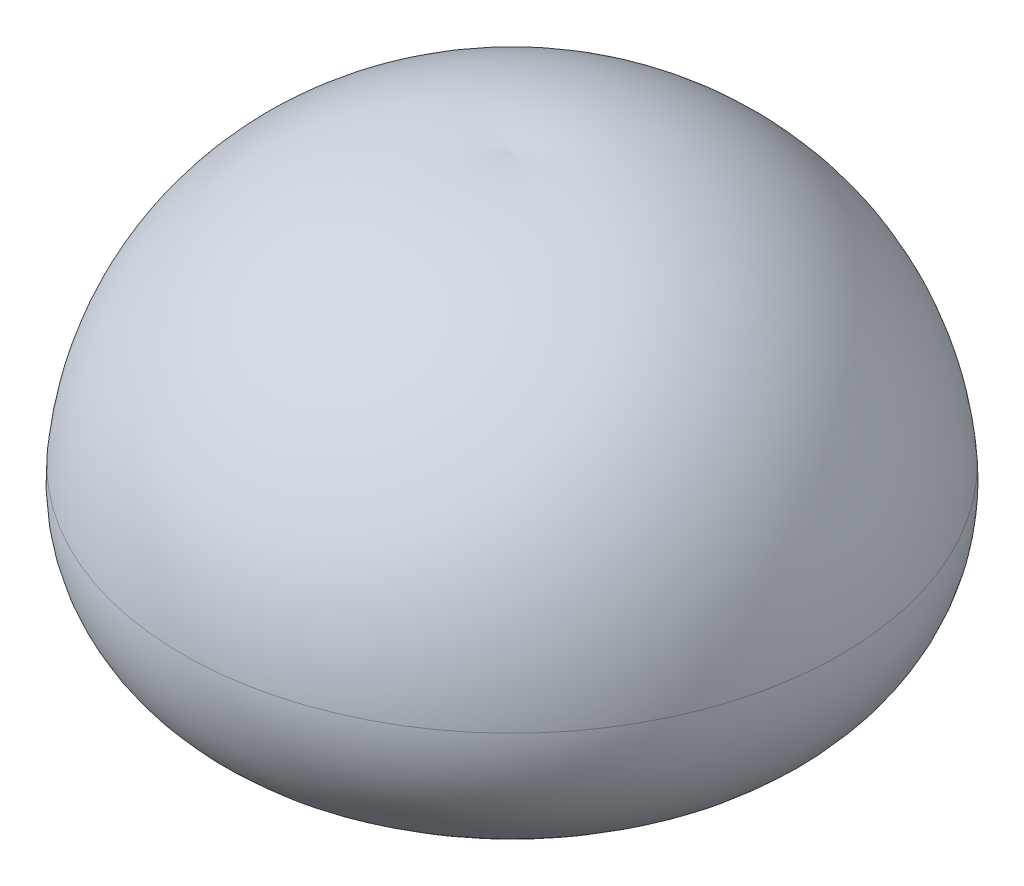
SolidWorks part; units mm, degrees
ref_plane "前视基准面" through (0, 0, 0) normal (0, 0, 1) x (1, 0, 0)
ref_plane "上视基准面" through (0, 0, 0) normal (0, 1, 0) x (1, 0, 0)
ref_plane "右视基准面" through (0, 0, 0) normal (1, 0, 0) x (0, 0, -1)
sketch "草图1" plane through (0, 0, 0) normal (0, 0, 1) x (1, 0, 0)
  line L0 (0, 860.3204) -> (0, -27.1227) construction
  line L1 (-196.265, 0) -> (315.568, 0) construction
  line L2 (300, 645) -> (-899.4452, 1337.5) construction
  line L3 (300, 645) -> (1679.7297, 765.7107) construction
  line L4 (300, 1071.2586) -> (300, 538.1611) construction
  line L5 (1679.7297, 765.7107) -> (1690.452, 965.4231) construction
  line L6 (1690.452, 965.4231) -> (3098.4242, 889.8304) construction
  line L7 (-899.4452, 1337.5) -> (-1022.7787, 1180.0553) construction
  line L8 (-1022.7787, 1180.0553) -> (-2132.7639, 2049.5569) construction
  line L9 (1679.7297, 765.7107) -> (1731.4935, 572.5255) construction
  line L10 (1731.4935, 572.5255) -> (369.5381, 207.5907) construction
  line L11 (1319.5558, 926.8817) -> (1319.5558, 45.241) construction
  line L12 (1319.5558, 45.241) -> (1296.2796, -86.7648) construction
  line L13 (1319.5558, 45.241) -> (1343.4101, -90.0433) construction
  line L14 (1319.5558, 190.9816) -> (1243.487, 234.8999) construction
  line L15 (1319.5558, 190.9816) -> (1430.874, 200.7207) construction
  line L16 (1319.5558, 372.2851) -> (1233.3752, 340.918) construction
  line L17 (1319.5558, 372.2851) -> (1338.973, 262.165) construction
  line L18 (1319.5558, 631.6387) -> (1370.1273, 492.6947) construction
  line L19 (1319.5558, 631.6387) -> (1271.182, 498.7326) construction
  line L20 (1319.5558, 817.0834) -> (1182.6552, 680.1828) construction
  line L21 (1319.5558, 817.0834) -> (1471.4957, 665.1436) construction
  line L22 (-899.4452, 1337.5) -> (-702.4836, 1302.7704) construction
  line L23 (-702.4836, 1302.7704) -> (-947.3276, -85.8086) construction
  line L24 (-899.4452, 1337.5) -> (-831.0412, 1525.4385) construction
  line L25 (-831.0412, 1525.4385) -> (493.9254, 1043.1901) construction
  line L26 (1679.7297, 765.7107) -> (1498.4681, 681.1871) construction
  line L27 (1498.4681, 681.1871) -> (902.5764, 1959.081) construction
  line L28 (0, -27.1227) -> (0, 0)
  line L29 (0, 2059.1808) -> (0, 3438.0485)
  arc A0 (3098.4242, 889.8304) -> (369.5381, 207.5907) centre (1679.7297, 765.7107) cw
  arc A1 (3098.4242, 889.8304) -> (-2132.7639, 2049.5569) centre (300, 645) ccw
  arc A2 (-2132.7639, 2049.5569) -> (-947.3276, -85.8086) centre (-899.4452, 1337.5) ccw
  arc A3 (-947.3276, -85.8086) -> (309.235, 2090.6216) centre (300, 645) cw
  arc A4 (369.5381, 207.5907) -> (493.9254, 1043.1901) centre (300, 645) ccw
  arc A5 (493.9254, 1043.1901) -> (309.235, 2090.6216) centre (-899.4452, 1337.5) ccw
  point P5 (300, 645)
  point P6 (300, 2030)
  point P7 (1710, 2230)
  point P8 (1950, 2230)
  point P14 (430, 2230)
  dimension "D20" = 3103.8434
  dimension "D1" = 200
  dimension "L12x" = 300
  dimension "D2" = 1410
  dimension "L23z" = 1385
  dimension "D3" = 170
  dimension "L12z" = 645
  dimension "D4" = 170
  dimension "L34mx" = 200
  dimension "D5" = 60
  dimension "L56z" = 240
  dimension "D6" = 85
  dimension "L35z" = 1410
  dimension "D7" = 85
  dimension "D8" = 60
  dimension "D9" = 1385
  dimension "L34z" = 130
  dimension "L45z" = 1280
  dimension "D10" = 110
  dimension "D11" = 170
  dimension "D12" = 200
  dimension "D13" = 200
  dimension "D14" = 135
  dimension "D15" = 135
  dimension "D16" = 260
  dimension "D17" = 20
  dimension "D18" = 260
  dimension "D19" = 20
revolve "旋转1" add sketch "草图1" angle 360 mid plane about L29
sketch "草图2" plane through (0, 0, 0) normal (0, 0, 1) x (1, 0, 0)
  line L0 (0, 860.3204) -> (0, -27.1227) construction
  line L1 (-196.265, 0) -> (315.568, 0) construction
  line L2 (300, 645) -> (-899.4452, 1337.5) construction
  line L3 (300, 645) -> (1679.7297, 765.7107) construction
  line L4 (300, 1071.2586) -> (300, 538.1611) construction
  line L5 (1679.7297, 765.7107) -> (1690.452, 965.4231) construction
  line L6 (1690.452, 965.4231) -> (3098.4242, 889.8304) construction
  line L7 (-899.4452, 1337.5) -> (-1022.7787, 1180.0553) construction
  line L8 (-1022.7787, 1180.0553) -> (-2132.7639, 2049.5569) construction
  line L9 (1679.7297, 765.7107) -> (1731.4935, 572.5255) construction
  line L10 (1731.4935, 572.5255) -> (369.5381, 207.5907) construction
  line L11 (1319.5558, 926.8817) -> (1319.5558, 45.241) construction
  line L12 (1319.5558, 45.241) -> (1296.2796, -86.7648) construction
  line L13 (1319.5558, 45.241) -> (1343.4101, -90.0433) construction
  line L14 (1319.5558, 190.9816) -> (1243.487, 234.8999) construction
  line L15 (1319.5558, 190.9816) -> (1430.874, 200.7207) construction
  line L16 (1319.5558, 372.2851) -> (1233.3752, 340.918) construction
  line L17 (1319.5558, 372.2851) -> (1338.973, 262.165) construction
  line L18 (1319.5558, 631.6387) -> (1370.1273, 492.6947) construction
  line L19 (1319.5558, 631.6387) -> (1271.182, 498.7326) construction
  line L20 (1319.5558, 817.0834) -> (1182.6552, 680.1828) construction
  line L21 (1319.5558, 817.0834) -> (1471.4957, 665.1436) construction
  line L22 (-899.4452, 1337.5) -> (-702.4836, 1302.7704) construction
  line L23 (-702.4836, 1302.7704) -> (-947.3276, -85.8086) construction
  line L24 (-899.4452, 1337.5) -> (-831.0412, 1525.4385) construction
  line L25 (-831.0412, 1525.4385) -> (493.9254, 1043.1901) construction
  line L26 (1679.7297, 765.7107) -> (1498.4681, 681.1871) construction
  line L27 (1498.4681, 681.1871) -> (902.5764, 1959.081) construction
  line L28 (0, -27.1227) -> (0, 0)
  line L29 (0, 2059.1808) -> (0, 3438.0485)
  arc A0 (3098.4242, 889.8304) -> (369.5381, 207.5907) centre (1679.7297, 765.7107) cw
  arc A1 (3098.4242, 889.8304) -> (-2132.7639, 2049.5569) centre (300, 645) ccw
  arc A2 (-2132.7639, 2049.5569) -> (-947.3276, -85.8086) centre (-899.4452, 1337.5) ccw
  arc A3 (-947.3276, -85.8086) -> (309.235, 2090.6216) centre (300, 645) cw
  arc A4 (369.5381, 207.5907) -> (493.9254, 1043.1901) centre (300, 645) ccw
  arc A5 (493.9254, 1043.1901) -> (309.235, 2090.6216) centre (-899.4452, 1337.5) ccw
  point P5 (300, 645)
  point P6 (300, 2030)
  point P7 (1710, 2230)
  point P8 (1950, 2230)
  point P14 (430, 2230)
  dimension "D20" = 3103.8434
  dimension "D1" = 200
  dimension "D2" = 1410
  dimension "L23z" = 1385
  dimension "D3" = 170
  dimension "D4" = 170
  dimension "L34mx" = 200
  dimension "D5" = 60
  dimension "L56z" = 240
  dimension "D6" = 85
  dimension "L35z" = 1410
  dimension "D7" = 85
  dimension "D8" = 60
  dimension "D9" = 1385
  dimension "L34z" = 130
  dimension "L45z" = 1280
  dimension "D10" = 110
  dimension "D11" = 170
  dimension "D12" = 200
  dimension "D13" = 200
  dimension "D14" = 135
  dimension "D15" = 135
  dimension "D16" = 260
  dimension "D17" = 20
  dimension "D18" = 260
  dimension "D19" = 20
revolve "旋转2" add sketch "草图2" angle 360 mid plane about L29
equation "\"D9@草图1\" = \"L23z@草图1\""
equation "\"D1@草图1\" = \"L34mx@草图1\""
equation "\"D2@草图1\" = \"L35z@草图1\""
equation "\"D7@草图1\" = \"D6@草图1\""
equation "\"D8@草图1\" = \"D5@草图1\""
equation "\"D16@草图1\" = \"D11@草图1\"+90"
equation "\"D17@草图1\" = \"D10@草图1\"-90"
equation "\"D18@草图1\" = \"D11@草图1\"+90"
equation "\"D19@草图1\" = \"D10@草图1\"-90"
